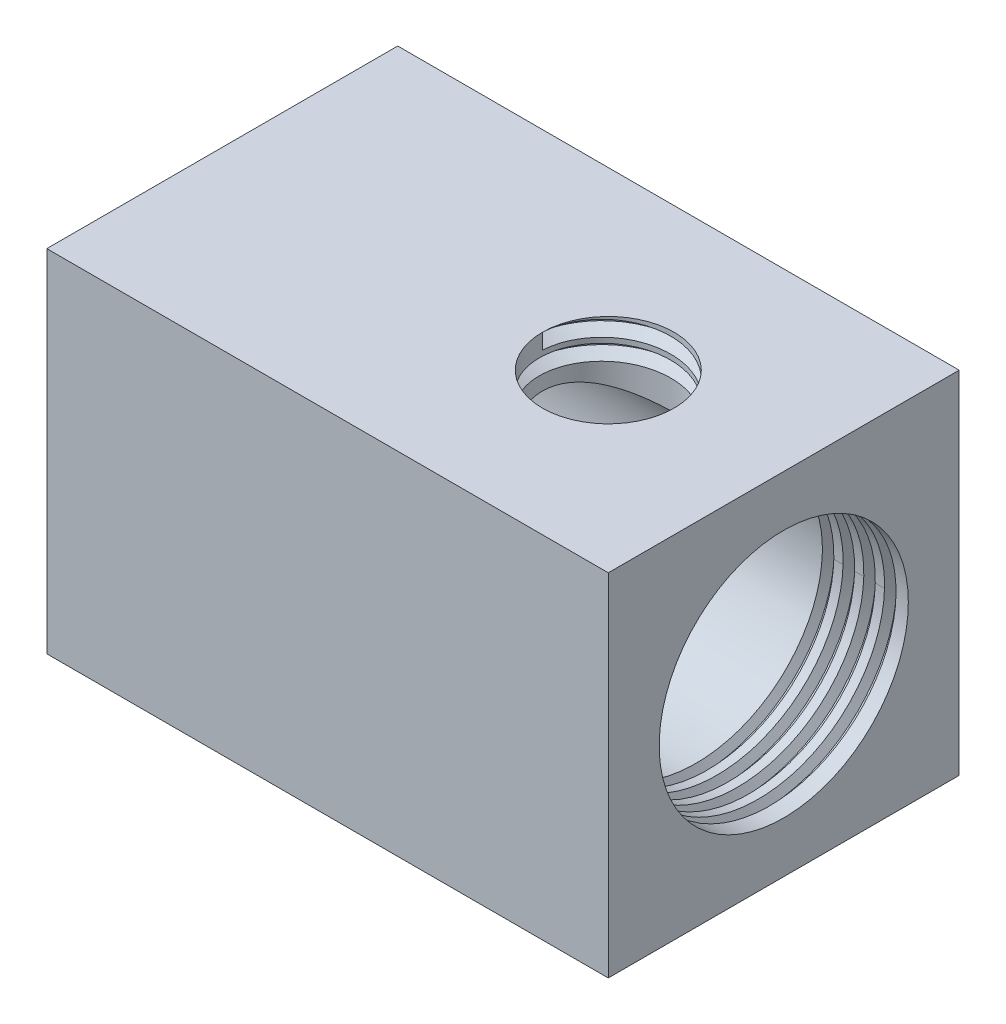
SolidWorks part; units mm, degrees
ref_plane "Front Plane" through (0, 0, 0) normal (0, 0, 1) x (1, 0, 0)
ref_plane "Top Plane" through (0, 0, 0) normal (0, 1, 0) x (1, 0, 0)
ref_plane "Right Plane" through (0, 0, 0) normal (1, 0, 0) x (0, 0, -1)
sketch "Sketch1" plane through (0, 0, 0) normal (0, 1, 0) x (1, 0, 0)
  line L1 (0, 0) -> (-40.64, 0)
  line L2 (0, 0) -> (0, 25.4)
  line L3 (0, 25.4) -> (-40.64, 25.4)
  line L4 (-40.64, 0) -> (-40.64, 25.4)
  dimension "D1" = 40.64
  dimension "D2" = 25.4
extrude "Boss-Extrude1" add sketch "Sketch1" along normal blind 25.4
sketch "Sketch2" plane through (-40.64, 0, 0) normal (-1, 0, 0) x (0, 0, 1)
  circle A0 centre (-12.7, 12.7) radius 0.0254
  dimension "D3" = 0.0508
  dimension "D1" = 12.7
  dimension "D2" = 12.7
extrude "Cut-Extrude1" cut sketch "Sketch2" against normal through all
sketch "Sketch11" plane through (0, 0, 0) normal (1, 0, 0) x (0, 0, -1)
  circle A0 centre (12.7, 12.6746) radius 8.89
  circle A1 centre (12.7, 12.7) radius 0.0254 construction
  point P4 (0, 0)
  point P7 (0, 0)
  dimension "D1" = 17.78
  dimension "D2" = 12.7
hole_wizard "43/64 (0.7) Diameter Hole1" positions "Sketch12" profile "Sketch14" hole size "43/64" standard "ANSI Inch"
sketch "Sketch12" plane through (0, 0, 0) normal (1, 0, 0) x (0, 0, -1)
  point P0 (12.7, 12.6746)
sketch "Sketch14" plane through (0, 12.6746, -12.7) normal (0, 1, 0) x (0, 0, -1)
  line L0 (0, 0) -> (0, 40.5207)
  line L1 (0, 40.5207) -> (8.89, 35.179)
  line L2 (8.89, 35.179) -> (8.89, 0)
  line L5 (8.89, 0) -> (0, 0)
  line L10 (0, 40.5207) -> (-8.89, 35.179) construction
  line L11 (0, -6.35) -> (0, 107.95) construction
  dimension "Hole Dia." = 17.78
  dimension "Hole Depth" = 35.179
  dimension "Drill Angle" = 118
sketch "Sketch3" plane through (0, 0, 0) normal (1, 0, 0) x (0, 0, -1)
  circle A0 centre (12.7, 12.7) radius 9.017
  dimension "D3" = 18.034
  dimension "D1" = 12.7
  dimension "D2" = 12.7
extrude "Cut-Extrude2" cut sketch "Sketch3" against normal blind 35.179
thread "Thread1" pitch 1.5 start angle 1, offset 0, length 6.35, pitch 1.5, diameter 17.526
ref_plane "Plane1" through (0, 12.8529, -3.9383) normal (0, -0.9998, 0.0175) x (0, 0.0175, 0.9998)
sketch "Thread Profile1" plane through (0, 12.8529, -3.9383) normal (0, -0.9998, 0.0175) x (0, 0.0175, 0.9998)
  line L0 (0, 0) -> (0, 1.5) construction
  line L1 (0, 0) -> (0.8119, 0.4687)
  line L2 (0.8119, 0.4687) -> (0.8119, 0.6562)
  line L3 (0.8119, 0.6562) -> (0, 1.125)
  line L4 (0.8119, 0.5625) -> (0, 0.5625) construction
  line L11 (0, 0) -> (0, 1.125)
  point P2 (0, 0)
  dimension "Pitch" = 1.5
  dimension "Profile_Angle" = 60
  dimension "Profile_Land" = 0.1875
  dimension "Profile_Height" = 0.8119
sketch "Sketch8" plane through (0, 25.4, 0) normal (0, 1, 0) x (1, 0, 0)
  circle A0 centre (-12.7, 12.7) radius 4.7625
  dimension "D3" = 9.525
  dimension "D1" = 12.7
  dimension "D2" = 12.7
extrude "Cut-Extrude3" cut sketch "Sketch8" against normal blind 11.938
thread "Thread2" pitch 1.5 start angle 0, offset 0, length 2.54, pitch 1.5, diameter 9.525
ref_plane "Plane2" through (-17.4625, 25.4, -12.7) normal (0, 0, 1) x (-1, 0, 0)
sketch "Thread Profile2" plane through (-17.4625, 25.4, -12.7) normal (0, 0, 1) x (-1, 0, 0)
  line L0 (0, 0) -> (0, 1.5) construction
  line L1 (0, 0) -> (0.8119, 0.4687)
  line L2 (0.8119, 0.4687) -> (0.8119, 0.6562)
  line L3 (0.8119, 0.6562) -> (0, 1.125)
  line L4 (0.8119, 0.5625) -> (0, 0.5625) construction
  line L11 (0, 0) -> (0, 1.125)
  point P2 (0, 0)
  dimension "Pitch" = 1.5
  dimension "Profile_Angle" = 60
  dimension "Profile_Land" = 0.1875
  dimension "Profile_Height" = 0.8119
ref_plane "Plane3" through (0, 12.7, 0) normal (0, 1, 0) x (1, 0, 0)
sketch "Sketch9" plane through (0, 12.7, 0) normal (0, 1, 0) x (1, 0, 0)
  line L0 (-35.1729, 21.8415) -> (-35.1729, 12.954)
  line L1 (-35.1729, 12.954) -> (-40.513, 12.954)
  line L2 (-40.513, 12.954) -> (-35.1729, 21.8415)
  line L3 (0, 25.4) -> (-40.64, 25.4) construction
  line L4 (-40.64, 25.4) -> (-40.64, 0) construction
  line L5 (-40.64, 0) -> (0, 0) construction
  line L6 (-40.64, 12.7) -> (0, 12.7) construction
  line L7 (0, 0) -> (0, 25.4) construction
  dimension "D1" = 31
  dimension "D2" = 12.954
  dimension "D3" = 8.8875
  dimension "D4" = 0.127
revolve "Cut-Revolve2" cut sketch "Sketch9" angle 360 about L6
sketch "Sketch15" plane through (0, 0, 0) normal (1, 0, 0) x (0, 0, -1)
  circle A0 centre (12.7, 12.6746) radius 0.2794
  dimension "D1" = 0.5588
extrude "Cut-Extrude4" cut sketch "Sketch15" against normal blind 40.513
equation "\"1.8inin\"=1.75"
